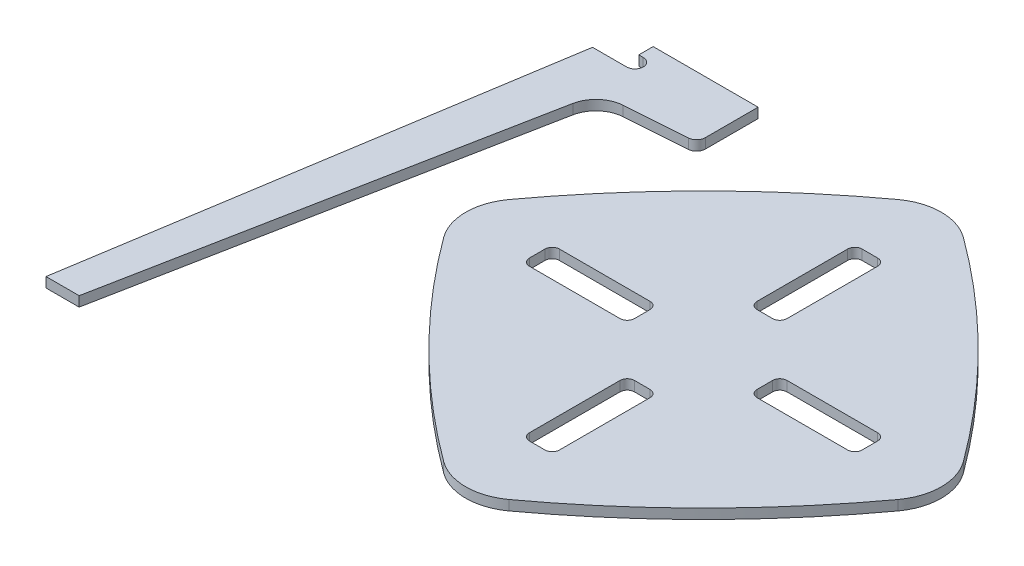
SolidWorks part; units mm, degrees
ref_plane "Alzado" through (0, 0, 0) normal (0, 0, 1) x (1, 0, 0)
ref_plane "Planta" through (0, 0, 0) normal (0, 1, 0) x (1, 0, 0)
ref_plane "Vista lateral" through (0, 0, 0) normal (1, 0, 0) x (0, 0, -1)
sketch "Croquis1" plane through (0, 0, 0) normal (1, 0, 0) x (0, 0, -1)
  line L0 (0, 201.875) -> (0, -285.625) construction
  line L1 (-200, 143.125) -> (-91.25, 143.125)
  line L2 (-200, 143.125) -> (-260, -226.875)
  line L3 (-260, -226.875) -> (-230, -226.875)
  line L4 (-230, -226.875) -> (-165.0258, 101.875)
  line L5 (-165.0258, 101.875) -> (-91.25, 101.875)
  line L6 (-91.25, 101.875) -> (-91.25, 143.125)
  dimension "D1" = 30
  dimension "D2" = 200
  dimension "D3" = 370
ref_plane "Plano2" through (0, 143.125, 0) normal (0, 1, 0) x (1, 0, 0)
sketch "Croquis3" plane through (0, 143.125, 0) normal (0, 1, 0) x (1, 0, 0)
  line L0 (0, 0) -> (0, -813.5605) construction
  line L1 (0, -226.2742) -> (226.2742, 0) construction
  line L2 (0, -226.2742) -> (-226.2742, 0) construction
  line L3 (-226.2742, 0) -> (0, 226.2742) construction
  line L4 (226.2742, 0) -> (0, 226.2742) construction
  line L5 (0, -226.2742) -> (0, 226.2742) construction
  line L6 (-226.2742, 0) -> (226.2742, 0) construction
  line L7 (0, 0) -> (113.1371, 113.1371) construction
  line L8 (165.2428, 0) -> (195.7585, -30.5157) construction
  line L9 (-287.0875, 186.6428) -> (-354.7428, -240.3572)
  line L10 (-354.7428, -240.3572) -> (-324.7428, -240.3572)
  line L11 (-324.7428, -240.3572) -> (-252.0381, 133.6756)
  line L12 (-172.6847, 158.9138) -> (-227.8736, 155.0547)
  line L13 (-165.2428, 166.8943) -> (-165.2428, 214.6428)
  line L14 (-165.2428, 186.6428) -> (-165.2428, 214.6428) construction
  line L15 (-165.2428, 214.6428) -> (-260.2428, 214.6428)
  line L16 (-260.2428, 214.6428) -> (-260.2428, 201.6428)
  line L17 (-260.2428, 186.6428) -> (-287.0875, 186.6428)
  line L18 (-260.2428, 186.6428) -> (-226.0935, 186.6428) construction
  line L19 (-260.2428, 186.6428) -> (-256.2428, 186.6428)
  line L20 (-256.2428, 186.6428) -> (-256.2428, 201.6428) construction
  line L21 (-256.2428, 201.6428) -> (-260.2428, 201.6428)
  arc A0 (-205.5537, 29.5809) -> (-29.5809, 205.5537) centre (455.5456, -455.5456) cw
  arc A1 (29.5809, 205.5537) -> (205.5537, 29.5809) centre (-455.5456, -455.5456) cw
  arc A2 (205.5537, -29.5809) -> (29.5809, -205.5537) centre (-455.5456, 455.5456) cw
  arc A3 (-29.5809, -205.5537) -> (-205.5537, -29.5809) centre (455.5456, 455.5456) cw
  arc A4 (205.5537, 29.5809) -> (205.5537, -29.5809) centre (165.2428, 0) cw
  arc A5 (29.5809, -205.5537) -> (-29.5809, -205.5537) centre (0, -165.2428) cw
  arc A6 (-29.5809, 205.5537) -> (29.5809, 205.5537) centre (0, 165.2428) cw
  arc A7 (-205.5537, 29.5809) -> (-205.5537, -29.5809) centre (-165.2428, 0) ccw
  arc A8 (-256.2428, 186.6428) -> (-256.2428, 201.6428) centre (-256.2428, 194.1428) ccw
  arc A9 (-227.8736, 155.0547) -> (-252.0381, 133.6756) centre (-226.025, 128.6192) ccw
  arc A10 (-165.2428, 166.8943) -> (-172.6847, 158.9138) centre (-173.2428, 166.8943) cw
  point P0 (0, 0)
  point P5 (213.6132, 12.661)
  point P22 (0, 226.2742)
  point P23 (0, 0)
  point P42 (-293.2046, 186.5927)
  dimension "D4" = 4
  dimension "D5" = 15
  dimension "D1" = 820
  dimension "D3" = 50
  dimension "D7" = 26.5
  dimension "D2" = 320
  dimension "D6" = 4
extrude "Saliente-Extruir1" add sketch "Croquis3" along normal blind 9
sketch "Sketch3" plane through (0, 152.125, 0) normal (0, 1, 0) x (1, 0, 0)
  line L0 (0, 0) -> (215.2428, 0) construction
  line L1 (-7.05, -55.5) -> (7.05, -55.5)
  line L2 (62, -13.55) -> (144, -13.55)
  line L3 (55.5, -7.05) -> (55.5, 7.05)
  line L4 (62, 13.55) -> (144, 13.55)
  line L5 (150.5, -7.05) -> (150.5, 7.05)
  line L6 (55.5, -13.55) -> (150.5, 13.55) construction
  line L7 (55.5, 13.55) -> (150.5, -13.55) construction
  line L8 (-13.55, -62) -> (-13.55, -144)
  line L9 (-7.05, -150.5) -> (7.05, -150.5)
  line L10 (13.55, -62) -> (13.55, -144)
  line L11 (-55.5, 7.05) -> (-55.5, -7.05)
  line L12 (-62, 13.55) -> (-144, 13.55)
  line L13 (-150.5, 7.05) -> (-150.5, -7.05)
  line L14 (-62, -13.55) -> (-144, -13.55)
  line L15 (7.05, 55.5) -> (-7.05, 55.5)
  line L16 (13.55, 62) -> (13.55, 144)
  line L17 (7.05, 150.5) -> (-7.05, 150.5)
  line L18 (-13.55, 62) -> (-13.55, 144)
  arc A1 (55.5, -7.05) -> (62, -13.55) centre (62, -7.05) ccw
  arc A2 (144, -13.55) -> (150.5, -7.05) centre (144, -7.05) ccw
  arc A3 (150.5, 7.05) -> (144, 13.55) centre (144, 7.05) ccw
  arc A4 (62, 13.55) -> (55.5, 7.05) centre (62, 7.05) ccw
  arc A5 (13.55, -62) -> (7.05, -55.5) centre (7.05, -62) ccw
  arc A6 (-7.05, -55.5) -> (-13.55, -62) centre (-7.05, -62) ccw
  arc A7 (-13.55, -144) -> (-7.05, -150.5) centre (-7.05, -144) ccw
  arc A8 (7.05, -150.5) -> (13.55, -144) centre (7.05, -144) ccw
  arc A9 (-62, -13.55) -> (-55.5, -7.05) centre (-62, -7.05) ccw
  arc A10 (-55.5, 7.05) -> (-62, 13.55) centre (-62, 7.05) ccw
  arc A11 (-144, 13.55) -> (-150.5, 7.05) centre (-144, 7.05) ccw
  arc A12 (-150.5, -7.05) -> (-144, -13.55) centre (-144, -7.05) ccw
  arc A13 (-13.55, 62) -> (-7.05, 55.5) centre (-7.05, 62) ccw
  arc A14 (7.05, 55.5) -> (13.55, 62) centre (7.05, 62) ccw
  arc A15 (13.55, 144) -> (7.05, 150.5) centre (7.05, 144) ccw
  arc A16 (-7.05, 150.5) -> (-13.55, 144) centre (-7.05, 144) ccw
  arc A17 (205.5537, -29.5809) -> (205.5537, 29.5809) centre (165.2428, 0) ccw construction
  point P6 (103, 0)
  point P25 (215.2428, 0)
  point P62 (0, 0)
  dimension "D3" = 6.5
  dimension "D1" = 27.1
  dimension "D2" = 95
  dimension "D4" = 103
  dimension "D5" = 4
extrude "Cut-Extrude3" cut sketch "Sketch3" against normal blind 78
